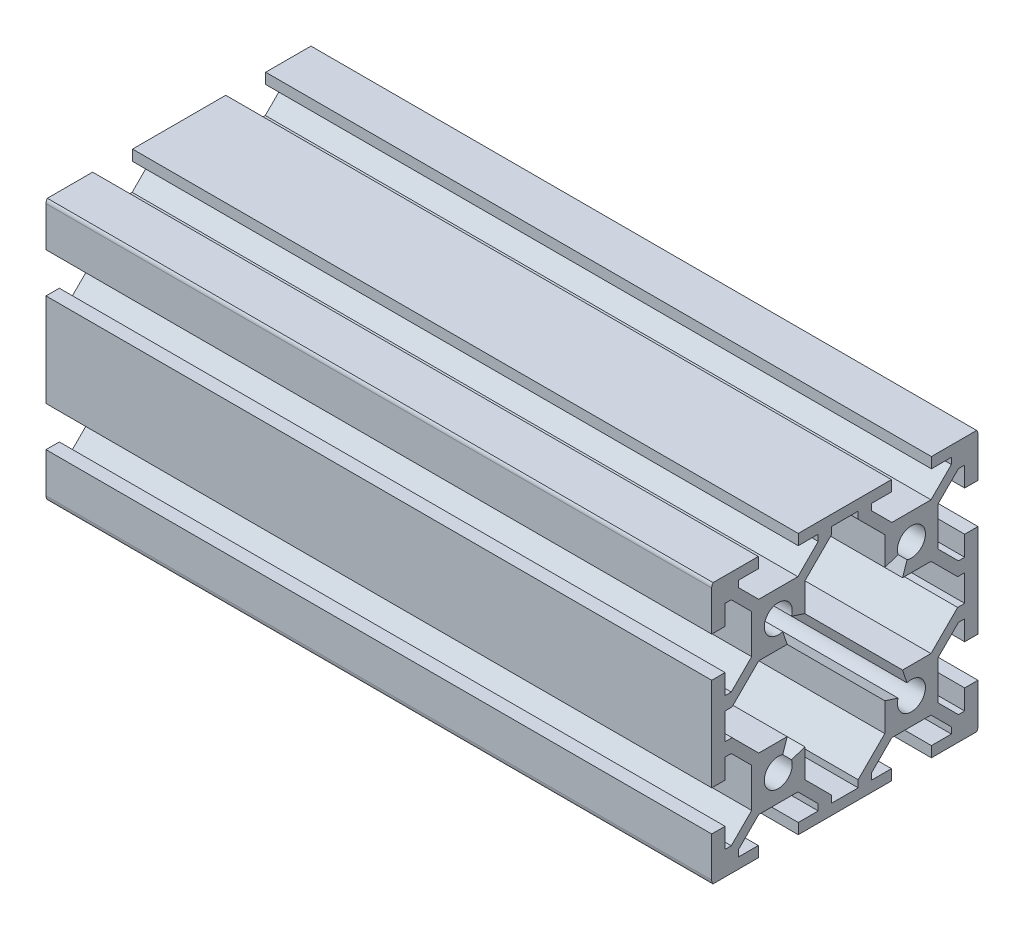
SolidWorks part; units mm, degrees
ref_plane "Front Plane" through (0, 0, 0) normal (0, 0, 1) x (1, 0, 0)
ref_plane "Top Plane" through (0, 0, 0) normal (0, 1, 0) x (1, 0, 0)
ref_plane "Right Plane" through (0, 0, 0) normal (1, 0, 0) x (0, 0, -1)
sketch "Sketch1" plane through (0, 0, 0) normal (1, 0, 0) x (0, 0, -1)
  line L0 (-16.9393, 2) -> (-18, 2)
  line L1 (-12.9393, 6) -> (-16.9393, 2)
  line L2 (-8.6667, 6) -> (-12.9393, 6)
  line L3 (-9.3359, 8.0078) -> (-8.6667, 6)
  line L4 (-6, 8.6667) -> (-8.0078, 9.3359)
  line L5 (-6, 12.9393) -> (-6, 8.6667)
  line L6 (-2, 16.9393) -> (-6, 12.9393)
  line L7 (-2, 18) -> (-2, 16.9393)
  line L8 (2, 18) -> (-2, 18)
  line L9 (2, 16.9393) -> (2, 18)
  line L10 (6, 12.9393) -> (2, 16.9393)
  line L11 (6, 8.6667) -> (6, 12.9393)
  line L12 (8.0078, 9.3359) -> (6, 8.6667)
  line L13 (8.6667, 6) -> (9.3359, 8.0078)
  line L14 (12.9393, 6) -> (8.6667, 6)
  line L15 (16.9393, 2) -> (12.9393, 6)
  line L16 (18, 2) -> (16.9393, 2)
  line L17 (18, -2) -> (18, 2)
  line L18 (16.9393, -2) -> (18, -2)
  line L19 (12.9393, -6) -> (16.9393, -2)
  line L20 (8.6667, -6) -> (12.9393, -6)
  line L21 (9.3359, -8.0078) -> (8.6667, -6)
  line L22 (6, -8.6667) -> (8.0078, -9.3359)
  line L23 (6, -12.9393) -> (6, -8.6667)
  line L24 (2, -16.9393) -> (6, -12.9393)
  line L25 (2, -18) -> (2, -16.9393)
  line L26 (-2, -18) -> (2, -18)
  line L27 (-2, -16.9393) -> (-2, -18)
  line L28 (-6, -12.9393) -> (-2, -16.9393)
  line L29 (-6, -8.6667) -> (-6, -12.9393)
  line L30 (-8.0078, -9.3359) -> (-6, -8.6667)
  line L31 (-8.6667, -6) -> (-9.3359, -8.0078)
  line L32 (-12.9393, -6) -> (-8.6667, -6)
  line L33 (-16.9393, -2) -> (-12.9393, -6)
  line L34 (-18, -2) -> (-16.9393, -2)
  line L35 (-18, 2) -> (-18, -2)
  line L36 (-20, 19) -> (-20, 13)
  line L37 (-20, 13) -> (-18, 13)
  line L38 (-18, 13) -> (-18, 16)
  line L39 (-18, 16) -> (-17.0607, 16)
  line L40 (-17.0607, 16) -> (-14, 12.9393)
  line L41 (-14, 12.9393) -> (-14, 7.0607)
  line L45 (-14, 7.0607) -> (-17.0607, 4)
  line L46 (-17.0607, 4) -> (-18, 4)
  line L47 (-18, 4) -> (-18, 7)
  line L48 (-18, 7) -> (-20, 7)
  line L49 (-20, 7) -> (-20, -7)
  line L50 (-20, -7) -> (-18, -7)
  line L51 (-18, -7) -> (-18, -4)
  line L52 (-18, -4) -> (-17.0607, -4)
  line L53 (-17.0607, -4) -> (-14, -7.0607)
  line L54 (-14, -7.0607) -> (-14, -12.9393)
  line L58 (-14, -12.9393) -> (-17.0607, -16)
  line L59 (-17.0607, -16) -> (-18, -16)
  line L60 (-18, -16) -> (-18, -13)
  line L61 (-18, -13) -> (-20, -13)
  line L62 (-20, -13) -> (-20, -19)
  line L63 (-19.8, -19.6) -> (-13, -19.6)
  line L64 (-13, -19.6) -> (-13, -18)
  line L65 (-13, -18) -> (-16, -18)
  line L66 (-16, -18) -> (-16, -17.0607)
  line L67 (-16, -17.0607) -> (-12.9393, -14)
  line L68 (-12.9393, -14) -> (-7.0607, -14)
  line L72 (-7.0607, -14) -> (-4, -17.0607)
  line L73 (-4, -17.0607) -> (-4, -18)
  line L74 (-4, -18) -> (-7, -18)
  line L75 (-7, -18) -> (-7, -19.6)
  line L76 (-7, -19.6) -> (7, -19.6)
  line L77 (7, -19.6) -> (7, -18)
  line L78 (7, -18) -> (4, -18)
  line L79 (4, -18) -> (4, -17.0607)
  line L80 (4, -17.0607) -> (7.0607, -14)
  line L81 (7.0607, -14) -> (12.9393, -14)
  line L85 (12.9393, -14) -> (16, -17.0607)
  line L86 (16, -17.0607) -> (16, -18)
  line L87 (16, -18) -> (13, -18)
  line L88 (13, -18) -> (13, -19.6)
  line L89 (13, -19.6) -> (19.8, -19.6)
  line L90 (20, -19) -> (20, -13)
  line L91 (20, -13) -> (18, -13)
  line L92 (18, -13) -> (18, -16)
  line L93 (18, -16) -> (17.0607, -16)
  line L94 (17.0607, -16) -> (14, -12.9393)
  line L98 (14, -12.9393) -> (14, -7.0607)
  line L99 (14, -7.0607) -> (17.0607, -4)
  line L100 (17.0607, -4) -> (18, -4)
  line L101 (18, -4) -> (18, -7)
  line L102 (18, -7) -> (20, -7)
  line L103 (20, -7) -> (20, 7)
  line L104 (20, 7) -> (18, 7)
  line L105 (18, 7) -> (18, 4)
  line L106 (18, 4) -> (17.0607, 4)
  line L107 (17.0607, 4) -> (14, 7.0607)
  line L111 (14, 7.0607) -> (14, 12.9393)
  line L112 (14, 12.9393) -> (17.0607, 16)
  line L113 (17.0607, 16) -> (18, 16)
  line L114 (18, 16) -> (18, 13)
  line L115 (18, 13) -> (20, 13)
  line L116 (20, 13) -> (20, 19)
  line L117 (19.8, 19.6) -> (13, 19.6)
  line L118 (13, 19.6) -> (13, 18)
  line L119 (13, 18) -> (16, 18)
  line L120 (16, 18) -> (16, 17.0607)
  line L121 (16, 17.0607) -> (12.9393, 14)
  line L125 (12.9393, 14) -> (7.0607, 14)
  line L126 (7.0607, 14) -> (4, 17.0607)
  line L127 (4, 17.0607) -> (4, 18)
  line L128 (4, 18) -> (7, 18)
  line L129 (7, 18) -> (7, 19.6)
  line L130 (7, 19.6) -> (-7, 19.6)
  line L131 (-7, 19.6) -> (-7, 18)
  line L132 (-7, 18) -> (-4, 18)
  line L133 (-4, 18) -> (-4, 17.0607)
  line L134 (-4, 17.0607) -> (-7.0607, 14)
  line L138 (-7.0607, 14) -> (-12.9393, 14)
  line L139 (-12.9393, 14) -> (-16, 17.0607)
  line L140 (-16, 17.0607) -> (-16, 18)
  line L141 (-16, 18) -> (-13, 18)
  line L142 (-13, 18) -> (-13, 19.6)
  line L143 (-13, 19.6) -> (-19.8, 19.6)
  arc A0 (-20, -19) -> (-19.8, -19.6) centre (-19, -19) ccw
  arc A1 (19.8, -19.6) -> (20, -19) centre (19, -19) ccw
  arc A2 (20, 19) -> (19.8, 19.6) centre (19, 19) ccw
  arc A3 (-19.8, 19.6) -> (-20, 19) centre (-19, 19) ccw
  arc A4 (-8.0078, 9.3359) -> (-9.3359, 8.0078) centre (-10, 10) ccw
  arc A5 (9.3359, 8.0078) -> (8.0078, 9.3359) centre (10, 10) ccw
  arc A6 (8.0078, -9.3359) -> (9.3359, -8.0078) centre (10, -10) ccw
  arc A7 (-9.3359, -8.0078) -> (-8.0078, -9.3359) centre (-10, -10) ccw
  dimension "A" = 40
  dimension "T" = 39.2
extrude "Boss-Extrude1" add sketch "Sketch1" along normal blind 100
ref_plane "Plane1" through (0, 19.6, 0) normal (0, 1, 0) x (1, 0, 0)
ref_plane "Plane2" through (0, 0, 0) normal (1, 0, 0) x (0, 0, -1)
ref_plane "Plane3" through (100, 0, 0) normal (1, 0, 0) x (0, 0, -1)
ref_plane "Plane4" through (7, 0, 0) normal (1, 0, 0) x (0, 0, -1)
ref_plane "Plane5" through (19, 0, 0) normal (1, 0, 0) x (0, 0, -1)
ref_plane "Plane6" through (31, 0, 0) normal (1, 0, 0) x (0, 0, -1)
ref_plane "Plane7" through (43, 0, 0) normal (1, 0, 0) x (0, 0, -1)
ref_plane "Plane8" through (55, 0, 0) normal (1, 0, 0) x (0, 0, -1)
sketch "Sketch2" [suppressed] plane through (7, 0, 0) normal (1, 0, 0) x (0, 0, -1)
  line L0 (10, -19.6) -> (12.75, -19.6)
  line L1 (12.75, -19.6) -> (12.75, 14)
  line L2 (12.75, 14) -> (14.75, 14)
  line L3 (14.75, 14) -> (14.75, 19.6)
  line L4 (14.75, 19.6) -> (10, 19.6)
  line L5 (10, 19.6) -> (10, -19.6) construction
  line L6 (10, 19.6) -> (10, -19.6)
  point P6 (10, 0)
  dimension "T" = 39.2
  dimension "FIX_3" = 5.6
  dimension "D1_s" = 9.5
  dimension "D_s" = 5.5
  dimension "FIX_4" = 10
revolve "Cut-Revolve1" [suppressed] cut sketch "Sketch2" angle 360 about L5
mirror "Mirror1" [suppressed] about plane through (0, 0, 0) normal (0, 0, 1)
sketch "Sketch3" [suppressed] plane through (18.5, 0, 0) normal (1, 0, 0) x (0, 0, -1)
  line L0 (10, -19.6) -> (12.75, -19.6)
  line L1 (12.75, -19.6) -> (12.75, 14)
  line L2 (12.75, 14) -> (14.75, 14)
  line L3 (14.75, 14) -> (14.75, 19.6)
  line L4 (14.75, 19.6) -> (10, 19.6)
  line L5 (10, 19.6) -> (10, -19.6) construction
  line L6 (10, 19.6) -> (10, -19.6)
  point P6 (10, 0)
  dimension "T" = 39.2
  dimension "FIX_6" = 5.6
  dimension "D1_s" = 9.5
  dimension "D_s" = 5.5
  dimension "FIX_7" = 10
revolve "Cut-Revolve2" [suppressed] cut sketch "Sketch3" angle 360 about L5
mirror "Mirror2" [suppressed] about plane through (0, 0, 0) normal (0, 0, 1)
sketch "Sketch4" [suppressed] plane through (30, 0, 0) normal (1, 0, 0) x (0, 0, -1)
  line L0 (10, -19.6) -> (12.75, -19.6)
  line L1 (12.75, -19.6) -> (12.75, 14)
  line L2 (12.75, 14) -> (14.75, 14)
  line L3 (14.75, 14) -> (14.75, 19.6)
  line L4 (14.75, 19.6) -> (10, 19.6)
  line L5 (10, 19.6) -> (10, -19.6) construction
  line L6 (10, 19.6) -> (10, -19.6)
  point P6 (10, 0)
  dimension "T" = 39.2
  dimension "FIX_9" = 5.6
  dimension "D1_s" = 9.5
  dimension "D_s" = 5.5
  dimension "FIX_10" = 10
revolve "Cut-Revolve3" [suppressed] cut sketch "Sketch4" angle 360 about L5
mirror "Mirror3" [suppressed] about plane through (0, 0, 0) normal (0, 0, 1)
sketch "Sketch5" [suppressed] plane through (41.5, 0, 0) normal (1, 0, 0) x (0, 0, -1)
  line L0 (10, -19.6) -> (12.75, -19.6)
  line L1 (12.75, -19.6) -> (12.75, 14)
  line L2 (12.75, 14) -> (14.75, 14)
  line L3 (14.75, 14) -> (14.75, 19.6)
  line L4 (14.75, 19.6) -> (10, 19.6)
  line L5 (10, 19.6) -> (10, -19.6) construction
  line L6 (10, 19.6) -> (10, -19.6)
  point P6 (10, 0)
  dimension "T" = 39.2
  dimension "FIX_12" = 5.6
  dimension "D1_s" = 9.5
  dimension "D_s" = 5.5
  dimension "FIX_13" = 10
revolve "Cut-Revolve4" [suppressed] cut sketch "Sketch5" angle 360 about L5
mirror "Mirror4" [suppressed] about plane through (0, 0, 0) normal (0, 0, 1)
sketch "Sketch6" [suppressed] plane through (53, 0, 0) normal (1, 0, 0) x (0, 0, -1)
  line L0 (10, -19.6) -> (12.75, -19.6)
  line L1 (12.75, -19.6) -> (12.75, 14)
  line L2 (12.75, 14) -> (14.75, 14)
  line L3 (14.75, 14) -> (14.75, 19.6)
  line L4 (14.75, 19.6) -> (10, 19.6)
  line L5 (10, 19.6) -> (10, -19.6) construction
  line L6 (10, 19.6) -> (10, -19.6)
  point P6 (10, 0)
  dimension "T" = 39.2
  dimension "FIX_15" = 5.6
  dimension "D1_s" = 9.5
  dimension "D_s" = 5.5
  dimension "FIX_16" = 10
revolve "Cut-Revolve5" [suppressed] cut sketch "Sketch6" angle 360 about L5
mirror "Mirror5" [suppressed] about plane through (0, 0, 0) normal (0, 0, 1)
sketch "Sketch7" [suppressed] plane through (0, 19.6, 0) normal (0, 1, 0) x (1, 0, 0)
  circle A0 centre (7, -10) radius 3.675
  circle A1 centre (7, 10) radius 3.675
  dimension "D" = 7.35
  dimension "AV" = 7
  dimension "FIX_18" = 20
  dimension "FIX_19" = 10
extrude "Cut-Extrude1" [suppressed] cut sketch "Sketch7" against normal blind 39.2
sketch "Sketch8" [suppressed] plane through (0, 19.6, 0) normal (0, 1, 0) x (1, 0, 0)
  circle A0 centre (18.5, -10) radius 3.675
  circle A1 centre (18.5, 10) radius 3.675
  dimension "D" = 7.35
  dimension "BV" = 19
  dimension "FIX_20" = 10
  dimension "FIX_21" = 20
extrude "Cut-Extrude2" [suppressed] cut sketch "Sketch8" against normal blind 39.2
sketch "Sketch9" [suppressed] plane through (0, 19.6, 0) normal (0, 1, 0) x (1, 0, 0)
  circle A0 centre (30, -10) radius 3.675
  circle A1 centre (30, 10) radius 3.675
  dimension "D" = 7.35
  dimension "CV" = 31
  dimension "FIX_22" = 20
  dimension "FIX_23" = 10
extrude "Cut-Extrude3" [suppressed] cut sketch "Sketch9" against normal blind 39.2
sketch "Sketch10" [suppressed] plane through (0, 19.6, 0) normal (0, 1, 0) x (1, 0, 0)
  circle A0 centre (41.5, -10) radius 3.675
  circle A1 centre (41.5, 10) radius 3.675
  dimension "D" = 7.35
  dimension "DV" = 43
  dimension "FIX_24" = 10
  dimension "FIX_25" = 20
extrude "Cut-Extrude4" [suppressed] cut sketch "Sketch10" against normal blind 39.2
sketch "Sketch11" [suppressed] plane through (0, 19.6, 0) normal (0, 1, 0) x (1, 0, 0)
  circle A0 centre (53, -10) radius 3.675
  circle A1 centre (53, 10) radius 3.675
  dimension "D" = 7.35
  dimension "EV" = 55
  dimension "FIX_26" = 10
  dimension "FIX_27" = 20
extrude "Cut-Extrude5" [suppressed] cut sketch "Sketch11" against normal blind 39.2
sketch "Sketch12" [suppressed] plane through (0, 0, 0) normal (1, 0, 0) x (0, 0, -1)
  circle A0 centre (-10, -10) radius 2.1
  circle A1 centre (10, -10) radius 2.1
  circle A2 centre (10, 10) radius 2.1
  circle A3 centre (-10, 10) radius 2.1
  dimension "FIX_28" = 4.2
  dimension "FIX_29" = 20
  dimension "FIX_30" = 20
  dimension "FIX_31" = 10
  dimension "FIX_32" = 10
extrude "Boss-Extrude2" [suppressed] add sketch "Sketch12" along normal blind 15
hole_wizard "Tapped Hole1" positions "Sketch14" profile "Sketch13" tap size "M5x0.8" standard "JIS"
sketch "Sketch14" [suppressed] plane through (0, 0, 0) normal (1, 0, 0) x (0, 0, -1)
  point P0 (10, 10)
  point P2 (-10, 10)
  point P4 (10, -10)
  point P6 (-10, -10)
  dimension "FIX_34" = 20
  dimension "FIX_35" = 20
  dimension "FIX_36" = 10
  dimension "FIX_37" = 10
sketch "Sketch13" [suppressed] plane through (0, 10, -10) normal (0, 1, 0) x (0, 0, 1)
  line L0 (0, 0) -> (0, 15)
  line L1 (0, 15) -> (2.1, 15)
  line L2 (2.1, 15) -> (2.1, 0)
  line L5 (2.1, 0) -> (0, 0)
  line L11 (0, -6.35) -> (0, 107.95) construction
  dimension "Thru Tap Drill Dia." = 4.2
  dimension "Thru Tap Drill Depth" = 15
sketch "Sketch15" [suppressed] plane through (100, 0, 0) normal (1, 0, 0) x (0, 0, -1)
  circle A0 centre (-10, -10) radius 2.1
  circle A1 centre (10, -10) radius 2.1
  circle A2 centre (10, 10) radius 2.1
  circle A3 centre (-10, 10) radius 2.1
  dimension "FIX_39" = 4.2
  dimension "FIX_38" = 20
  dimension "FIX_40" = 10
  dimension "FIX_41" = 10
  dimension "FIX_42" = 20
extrude "Boss-Extrude3" [suppressed] add sketch "Sketch15" against normal blind 15
hole_wizard "Tapped Hole2" positions "Sketch17" profile "Sketch16" tap size "M5x0.8" standard "JIS"
sketch "Sketch17" [suppressed] plane through (100, 0, 0) normal (1, 0, 0) x (0, 0, -1)
  point P0 (-10, 10)
  point P2 (10, 10)
  point P4 (-10, -10)
  point P6 (10, -10)
  dimension "FIX_44" = 20
  dimension "FIX_45" = 20
  dimension "FIX_46" = 10
  dimension "FIX_47" = 10
sketch "Sketch16" [suppressed] plane through (100, 10, 10) normal (0, 1, 0) x (0, 0, -1)
  line L0 (0, 0) -> (0, 15)
  line L1 (0, 15) -> (2.1, 15)
  line L2 (2.1, 15) -> (2.1, 0)
  line L5 (2.1, 0) -> (0, 0)
  line L11 (0, -6.35) -> (0, 107.95) construction
  dimension "Thru Tap Drill Dia." = 4.2
  dimension "Thru Tap Drill Depth" = 15
sketch "Sketch18" [suppressed] plane through (0, 0, 0) normal (1, 0, 0) x (0, 0, -1)
  circle A1 centre (-10, -10) radius 2.1
  circle A2 centre (10, -10) radius 2.1
  circle A3 centre (10, 10) radius 2.1
  circle A4 centre (-10, 10) radius 2.1
  dimension "FIX_48" = 4.2
  dimension "FIX_49" = 20
  dimension "FIX_50" = 20
  dimension "FIX_51" = 10
  dimension "FIX_52" = 10
extrude "Boss-Extrude4" [suppressed] add sketch "Sketch18" along normal blind 15
sketch "Sketch19" [suppressed] plane through (100, 0, 0) normal (1, 0, 0) x (0, 0, -1)
  circle A0 centre (-10, -10) radius 2.1
  circle A1 centre (10, -10) radius 2.1
  circle A2 centre (10, 10) radius 2.1
  circle A3 centre (-10, 10) radius 2.1
  dimension "FIX_56" = 4.2
  dimension "FIX_54" = 20
  dimension "FIX_55" = 20
  dimension "FIX_57" = 10
  dimension "FIX_58" = 10
extrude "Boss-Extrude5" [suppressed] add sketch "Sketch19" against normal blind 15
hole_wizard "Tapped Hole3" positions "Sketch21" profile "Sketch20" tap size "M5x0.8" standard "JIS"
sketch "Sketch21" [suppressed] plane through (0, 0, 0) normal (1, 0, 0) x (0, 0, -1)
  point P0 (10, 10)
  point P2 (-10, 10)
  point P4 (-10, -10)
  point P6 (10, -10)
  dimension "FIX_60" = 20
  dimension "FIX_61" = 10
  dimension "FIX_62" = 20
  dimension "FIX_63" = 10
sketch "Sketch20" [suppressed] plane through (0, 10, -10) normal (0, 1, 0) x (0, 0, 1)
  line L0 (0, 0) -> (0, 15)
  line L1 (0, 15) -> (2.1, 15)
  line L2 (2.1, 15) -> (2.1, 0)
  line L5 (2.1, 0) -> (0, 0)
  line L11 (0, -6.35) -> (0, 107.95) construction
  dimension "Thru Tap Drill Dia." = 4.2
  dimension "Thru Tap Drill Depth" = 15
hole_wizard "Tapped Hole4" positions "Sketch23" profile "Sketch22" tap size "M5x0.8" standard "JIS"
sketch "Sketch23" [suppressed] plane through (100, 0, 0) normal (1, 0, 0) x (0, 0, -1)
  point P0 (-10, 10)
  point P2 (10, 10)
  point P4 (-10, -10)
  point P6 (10, -10)
  dimension "FIX_64" = 20
  dimension "FIX_65" = 20
  dimension "FIX_66" = 10
  dimension "FIX_67" = 10
sketch "Sketch22" [suppressed] plane through (100, 10, 10) normal (0, 1, 0) x (0, 0, -1)
  line L0 (0, 0) -> (0, 15)
  line L1 (0, 15) -> (2.1, 15)
  line L2 (2.1, 15) -> (2.1, 0)
  line L5 (2.1, 0) -> (0, 0)
  line L11 (0, -6.35) -> (0, 107.95) construction
  dimension "Thru Tap Drill Dia." = 4.2
  dimension "Thru Tap Drill Depth" = 15
